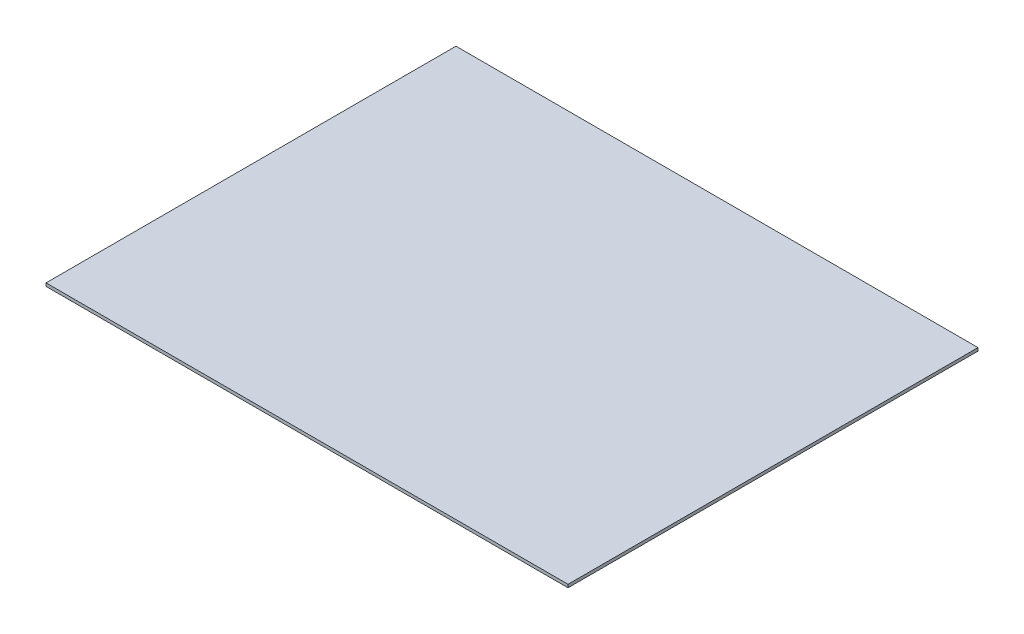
SolidWorks part; units mm, degrees
ref_plane "Front Plane" through (0, 0, 0) normal (0, 0, 1) x (1, 0, 0)
ref_plane "Top Plane" through (0, 0, 0) normal (0, 1, 0) x (1, 0, 0)
ref_plane "Right Plane" through (0, 0, 0) normal (1, 0, 0) x (0, 0, -1)
sketch "Sketch1" plane through (0, 0, 0) normal (0, 1, 0) x (1, 0, 0)
  line L1 (-170, -133.5) -> (170, -133.5)
  line L2 (-170, -133.5) -> (-170, 133.5)
  line L3 (-170, 133.5) -> (170, 133.5)
  line L4 (170, -133.5) -> (170, 133.5)
  line L5 (-170, -133.5) -> (170, 133.5) construction
  line L6 (-170, 133.5) -> (170, -133.5) construction
  point P0 (0, 0)
  dimension "D1" = 340
  dimension "D2" = 267
extrude "Boss-Extrude1" add sketch "Sketch1" along normal blind 2
